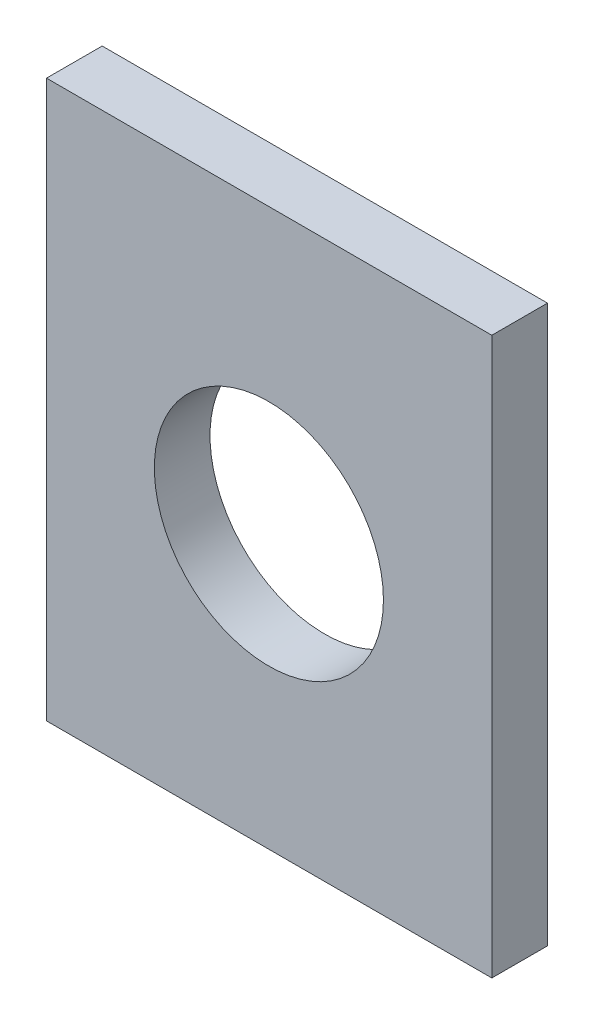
SolidWorks part; units mm, degrees
ref_plane "Ebene vorne" through (0, 0, 0) normal (0, 0, 1) x (1, 0, 0)
ref_plane "Ebene oben" through (0, 0, 0) normal (0, 1, 0) x (1, 0, 0)
ref_plane "Ebene rechts" through (0, 0, 0) normal (1, 0, 0) x (0, 0, -1)
sketch "Skizze1" plane through (0, 0, 0) normal (0, 0, 1) x (1, 0, 0)
  line L1 (0, 0) -> (80, 0)
  line L2 (0, 0) -> (0, 100)
  line L3 (0, 100) -> (80, 100)
  line L4 (80, 0) -> (80, 100)
  dimension "D1" = 100
  dimension "D2" = 80
extrude "Linear austragen1" add sketch "Skizze1" along normal blind 10
sketch "Skizze2" plane through (0, 0, 10) normal (0, 0, 1) x (1, 0, 0)
  circle A0 centre (39.9492, 49.0671) radius 20.578
extrude "Linear austragen2" cut sketch "Skizze2" against normal blind 10
sketch "Skizze3" [suppressed] plane through (0, 0, 10) normal (0, 0, 1) x (1, 0, 0)
  line L1 (5.2479, 91.1542) -> (22.1476, 91.1542)
  line L2 (5.2479, 91.1542) -> (5.2479, 75.6953)
  line L3 (5.2479, 75.6953) -> (22.1476, 75.6953)
  line L4 (22.1476, 91.1542) -> (22.1476, 75.6953)
extrude "Linear austragen3" [suppressed] cut sketch "Skizze3" against normal blind 10
